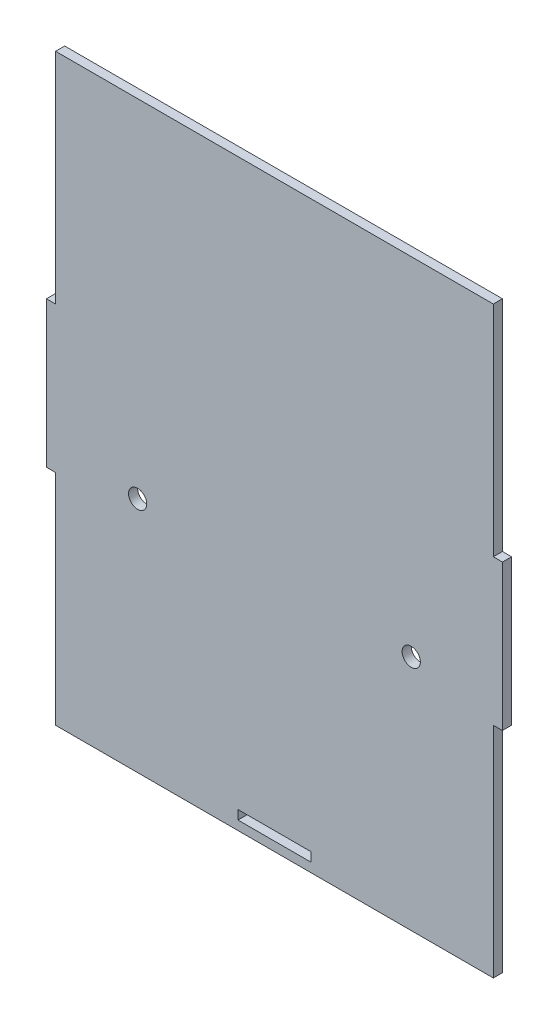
SolidWorks part; units mm, degrees
ref_plane "Front Plane" through (0, 0, 0) normal (0, 0, 1) x (1, 0, 0)
ref_plane "Top Plane" through (0, 0, 0) normal (0, 1, 0) x (1, 0, 0)
ref_plane "Right Plane" through (0, 0, 0) normal (1, 0, 0) x (0, 0, -1)
sketch "Sketch1" plane through (0, 0, 0) normal (0, 0, 1) x (1, 0, 0)
  line L0 (-48.1058, -98.6175) -> (-48.1058, -174.8175)
  line L1 (-48.1058, 28.3825) -> (104.2942, 28.3825)
  line L2 (-48.1058, 28.3825) -> (-48.1058, -47.8175)
  line L3 (-48.1058, -174.8175) -> (104.2942, -174.8175)
  line L4 (104.2942, 28.3825) -> (104.2942, -47.8175)
  line L5 (15.3942, -168.4675) -> (40.7942, -168.4675)
  line L6 (15.3942, -168.4675) -> (15.3942, -171.6425)
  line L7 (15.3942, -171.6425) -> (40.7942, -171.6425)
  line L8 (40.7942, -168.4675) -> (40.7942, -171.6425)
  line L9 (-48.1058, -47.8175) -> (-51.2808, -47.8175)
  line L10 (104.2942, -98.6175) -> (104.2942, -174.8175)
  line L11 (-48.1058, -98.6175) -> (-51.2808, -98.6175)
  line L12 (-51.2808, -47.8175) -> (-51.2808, -98.6175)
  line L13 (104.2942, -47.8175) -> (107.4692, -47.8175)
  line L15 (104.2942, -98.6175) -> (107.4692, -98.6175)
  line L16 (107.4692, -47.8175) -> (107.4692, -98.6175)
  circle A0 centre (-19.5308, -92.2675) radius 3.175
  circle A1 centre (75.7192, -92.2675) radius 3.175
  dimension "D13" = 6.35
  dimension "D14" = 6.35
  dimension "D1" = 152.4
  dimension "D2" = 203.2
  dimension "D3" = 3.175
  dimension "D4" = 3.175
  dimension "D5" = 63.5
  dimension "D6" = 25.4
  dimension "D7" = 50.8
  dimension "D8" = 50.8
  dimension "D9" = 3.175
  dimension "D10" = 3.175
  dimension "D11" = 76.2
  dimension "D12" = 76.2
  dimension "D15" = 28.575
  dimension "D16" = 28.575
  dimension "D17" = 82.55
  dimension "D18" = 82.55
extrude "Boss-Extrude1" add sketch "Sketch1" along normal blind 3.175
